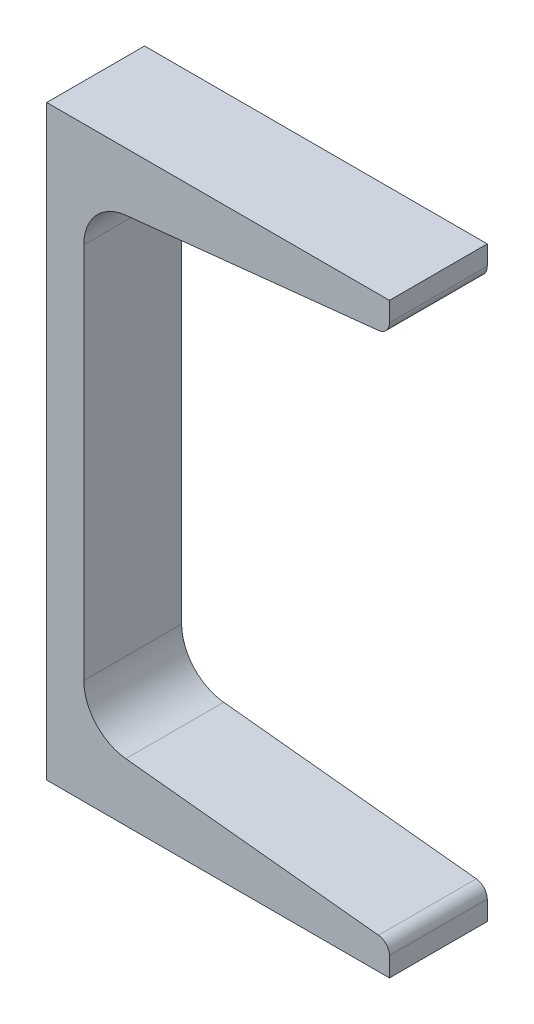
SolidWorks part; units mm, degrees
ref_plane "Plane1" through (0, 0, 0) normal (0, 0, 1) x (1, 0, 0)
ref_plane "Plane2" through (0, 0, 0) normal (0, 1, 0) x (-1, 0, 0)
ref_plane "Plane3" through (0, 0, 0) normal (1, 0, 0) x (0, 0, -1)
other "Configuration Table"
sketch "Sketch1"
extrude "BaseMchannel" add sketch "Sketch1" along normal mid plane 25.4
fillet "ToeFillet" radius 3.175 2 edges at (89.0016, 7.8937, 0) (89.0016, 144.5063, 0)
equation "\"d1@Sketch1\" = \"Depth@Sketch1\" - 2*\"TF@Sketch1\" -  2*( \"RI@Sketch1\" * cos(\"D2@Sketch1\"/180*3.141592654))-2*((((\"BF@Sketch1\"-\"TW@Sketch1\")/2)-(\"RI@Sketch1\"-\"RI@Sketch1\"*sin(\"D2@Sketch1\"/180*3.141592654"
equation "\"D3@Sketch1\" =  ( \"Depth@Sketch1\" - \"d1@Sketch1\" )  / 2"
